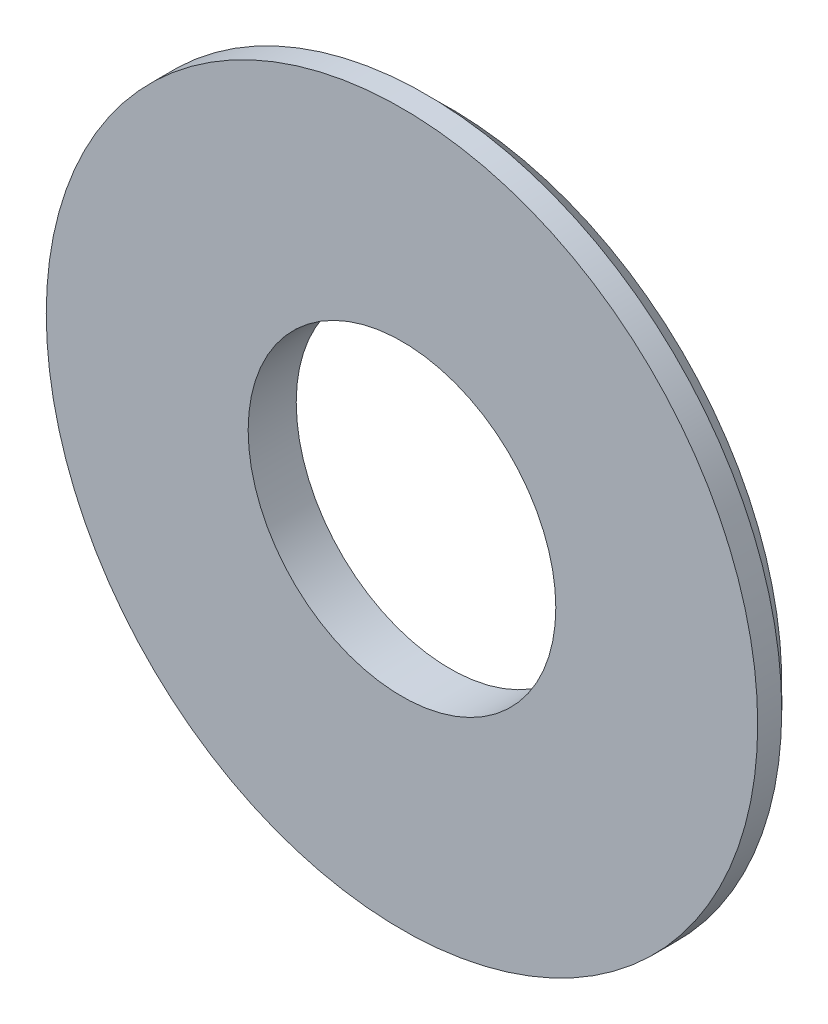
SolidWorks part; units mm, degrees
ref_plane "Alzado" through (0, 0, 0) normal (0, 0, 1) x (1, 0, 0)
ref_plane "Planta" through (0, 0, 0) normal (0, 1, 0) x (1, 0, 0)
ref_plane "Vista lateral" through (0, 0, 0) normal (1, 0, 0) x (0, 0, -1)
ref_plane "Plano1" through (0, 25.3403, 0) normal (0, -1, 0) x (1, 0, 0)
sketch "Croquis1" plane through (0, 25.3403, 0) normal (0, -1, 0) x (1, 0, 0)
  line L0 (-802.8273, -108.1238) -> (-802.5773, -107.8738)
  line L1 (-802.5773, -107.8738) -> (-802.5773, -107.6238)
  line L2 (-802.5773, -107.6238) -> (-804.6773, -107.6238)
  line L3 (-804.6773, -107.6238) -> (-804.6773, -108.1238)
  line L4 (-804.6773, -108.1238) -> (-802.8273, -108.1238)
  line L5 (-806.2773, -107.6238) -> (-806.2773, -108.1238) construction
revolve "Revolución1" add sketch "Croquis1" angle 360 about L5
